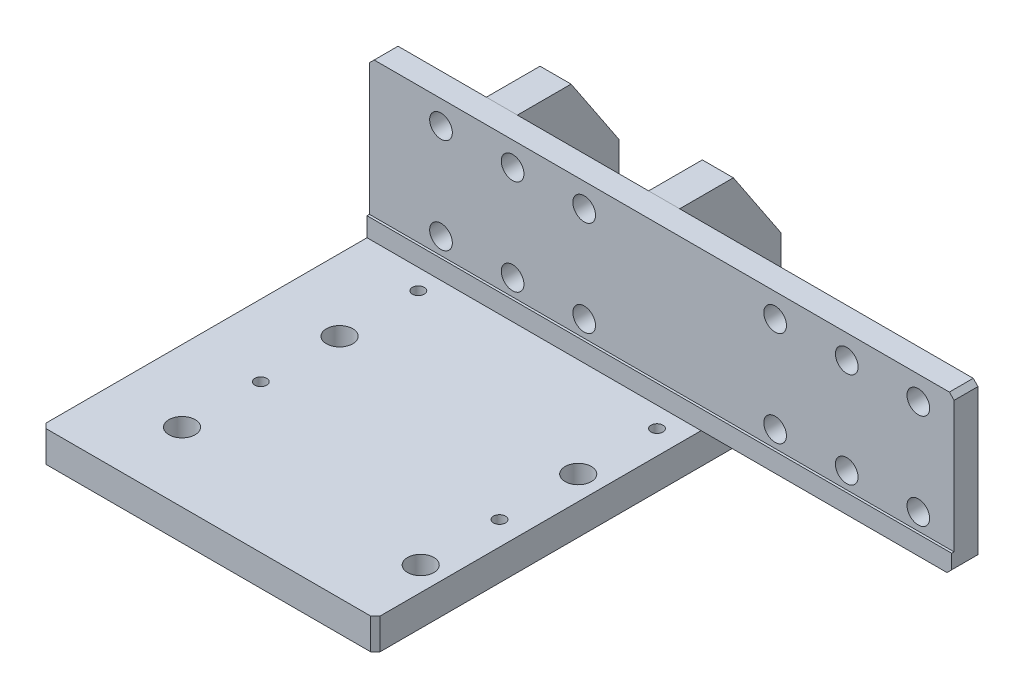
SolidWorks part; units mm, degrees
ref_plane "정면" through (0, 0, 0) normal (0, 0, 1) x (1, 0, 0)
ref_plane "윗면" through (0, 0, 0) normal (0, 1, 0) x (1, 0, 0)
ref_plane "우측면" through (0, 0, 0) normal (1, 0, 0) x (0, 0, -1)
sketch "스케치1" plane through (0, 0, 0) normal (0, 1, 0) x (1, 0, 0)
  line L1 (-70, 95) -> (70, 95)
  line L2 (-70, 95) -> (-70, -95)
  line L3 (-70, -95) -> (70, -95)
  line L4 (70, 95) -> (70, -95)
  line L5 (-70, 95) -> (70, -95) construction
  line L6 (-70, -95) -> (70, 95) construction
  point P0 (0, 0)
  dimension "D1" = 140
  dimension "D2" = 190
extrude "보스-돌출1" add sketch "스케치1" along normal blind 13
sketch "스케치2" plane through (0, 13, 0) normal (0, 1, 0) x (1, 0, 0)
  line L1 (175, 52.5) -> (-70, 52.5)
  line L2 (175, 52.5) -> (175, 41.5)
  line L3 (175, 41.5) -> (-70, 41.5)
  line L4 (-70, 52.5) -> (-70, 41.5)
  line L6 (-70, 95) -> (-70, -95) construction
  line L7 (70, 95) -> (-70, 95) construction
  dimension "D1" = 42.5
  dimension "D2" = 245
  dimension "D3" = 11
extrude "보스-돌출2" add sketch "스케치2" along normal blind 65 separate body
sketch "스케치3" plane through (0, 13, 0) normal (0, 1, 0) x (1, 0, 0)
  line L0 (70, 95) -> (-70, 95) construction
  line L1 (-31, 95) -> (-18, 95)
  line L2 (-31, 95) -> (-31, 52.5)
  line L3 (-31, 52.5) -> (-18, 52.5)
  line L4 (-18, 95) -> (-18, 52.5)
  line L5 (175, 52.5) -> (-70, 52.5) construction
  line L6 (70, -95) -> (70, 95) construction
  line L7 (37, 95) -> (50, 95)
  line L8 (37, 95) -> (37, 52.5)
  line L9 (37, 52.5) -> (50, 52.5)
  line L10 (50, 95) -> (50, 52.5)
  dimension "D1" = 20
  dimension "D2" = 13
  dimension "D3" = 55
extrude "보스-돌출3" add sketch "스케치3" along normal blind 65 separate body
sketch "스케치4" plane through (50, 0, 0) normal (1, 0, 0) x (0, 0, -1)
  line L0 (95, 78) -> (95, 48)
  line L1 (95, 78) -> (95, 13) construction
  line L2 (95, 48) -> (75, 78)
  line L3 (52.5, 78) -> (95, 78) construction
  line L4 (75, 78) -> (95, 78)
  dimension "D1" = 30
  dimension "D2" = 20
extrude "컷-돌출1" cut sketch "스케치4" against normal through all
sketch "스케치5" plane through (0, 0, -41.5) normal (0, 0, 1) x (1, 0, 0)
  line L0 (175, 78) -> (175, 13) construction
  line L1 (-70, 78) -> (175, 78)
  line L2 (-70, 78) -> (-70, 21)
  line L3 (-70, 21) -> (175, 21)
  line L4 (175, 78) -> (175, 21)
  line L5 (-70, 13) -> (175, 13) construction
  dimension "D1" = 8
extrude "컷-돌출2" cut sketch "스케치5" against normal blind 1
hole_wizard "M6 소켓 머리 캡 나사용 카운터보어1" positions "스케치6" profile "스케치7" counterbore size "M6" standard "KS"
sketch "스케치6" plane through (0, 13, 0) normal (0, 1, 0) x (1, 0, 0)
  line L1 (70, 95) -> (-70, 95) construction
  line L2 (70, -95) -> (70, 95) construction
  point P0 (-40, 66)
  point P2 (60, 66)
  point P26 (0, 0)
  point P27 (-40, 0)
  point P28 (-40, -66)
  point P29 (60, 0)
  point P30 (60, -66)
  dimension "D1" = 100
  dimension "D2" = 10
  dimension "D3" = 29
  dimension "D4" = 66
  dimension "D5" = 66
sketch "스케치7" plane through (-40, 13, -66) normal (1, 0, 0) x (0, 0, 1)
  line L0 (0, 0) -> (0, 13)
  line L1 (0, 13) -> (3.3, 13)
  line L3 (3.3, 13) -> (3.3, 8)
  line L4 (3.3, 8) -> (5.5, 8)
  line L5 (5.5, 8) -> (5.5, 0)
  line L7 (5.5, 0) -> (0, 0)
  line L11 (0, -6.35) -> (0, 107.95) construction
  dimension "관통 구멍 지름" = 6.6
  dimension "관통 구멍 깊이" = 13
  dimension "카운터보어 지름" = 11
  dimension "카운터보어 깊이" = 8
hole_wizard "Ø5.0mm 맞춤핀 구멍1" positions "스케치8" profile "스케치9" hole size "Ø5.0" standard "ISO"
sketch "스케치8" plane through (0, 13, 0) normal (0, 1, 0) x (1, 0, 0)
  line L0 (70, -95) -> (70, 95) construction
  line L1 (70, 95) -> (-70, 95) construction
  point P0 (-40, 33)
  point P2 (60, 33)
  point P4 (-40, -33)
  point P6 (60, -33)
  dimension "D1" = 10
  dimension "D2" = 100
  dimension "D3" = 62
  dimension "D4" = 66
sketch "스케치9" plane through (-40, 13, -33) normal (1, 0, 0) x (0, 0, 1)
  line L0 (0, 0) -> (0, 13)
  line L1 (0, 13) -> (2.5, 13)
  line L2 (2.5, 13) -> (2.5, 0)
  line L5 (2.5, 0) -> (0, 0)
  line L11 (0, -6.35) -> (0, 107.95) construction
  dimension "관통 구멍 지름" = 5
  dimension "관통 구멍 깊이" = 13
hole_wizard "M5 소켓 머리 캡 나사용 카운터보어1" positions "스케치12" profile "스케치13" counterbore size "M5" standard "KS"
sketch "스케치12" plane through (0, 0, -42.5) normal (0, 0, 1) x (1, 0, 0)
  line L0 (-70, 78) -> (-70, 21) construction
  line L1 (-70, 13) -> (70, 13) construction
  point P0 (-40, 68)
  point P2 (-10, 68)
  point P4 (20, 68)
  point P6 (-40, 28)
  point P8 (-10, 28)
  point P10 (20, 28)
  dimension "D1" = 30
  dimension "D2" = 30
  dimension "D3" = 30
  dimension "D4" = 15
  dimension "D5" = 40
sketch "스케치13" plane through (-40, 68, -42.5) normal (1, 0, 0) x (0, -1, 0)
  line L0 (0, 0) -> (0, 52.5)
  line L1 (0, 52.5) -> (2.75, 52.5)
  line L3 (2.75, 52.5) -> (2.75, 8)
  line L4 (2.75, 8) -> (4.75, 8)
  line L5 (4.75, 8) -> (4.75, 0)
  line L7 (4.75, 0) -> (0, 0)
  line L11 (0, -6.35) -> (0, 107.95) construction
  dimension "관통 구멍 지름" = 5.5
  dimension "관통 구멍 깊이" = 52.5
  dimension "카운터보어 지름" = 9.5
  dimension "카운터보어 깊이" = 8
pattern_linear "선형 패턴1" count 2 spacing 140 along (1, 0, 0) of "M5 소켓 머리 캡 나사용 카운터보어1"
chamfer "모따기1" distance 2 angle 45 3 edges at (175, 78, -47.5) (175, 13, -47) (-70, 78, -47.5)
chamfer "모따기2" distance 2 angle 45 4 edges at (70, 6.5, -95) (-70, 6.5, -95) (70, 6.5, 95) (-70, 6.5, 95)
